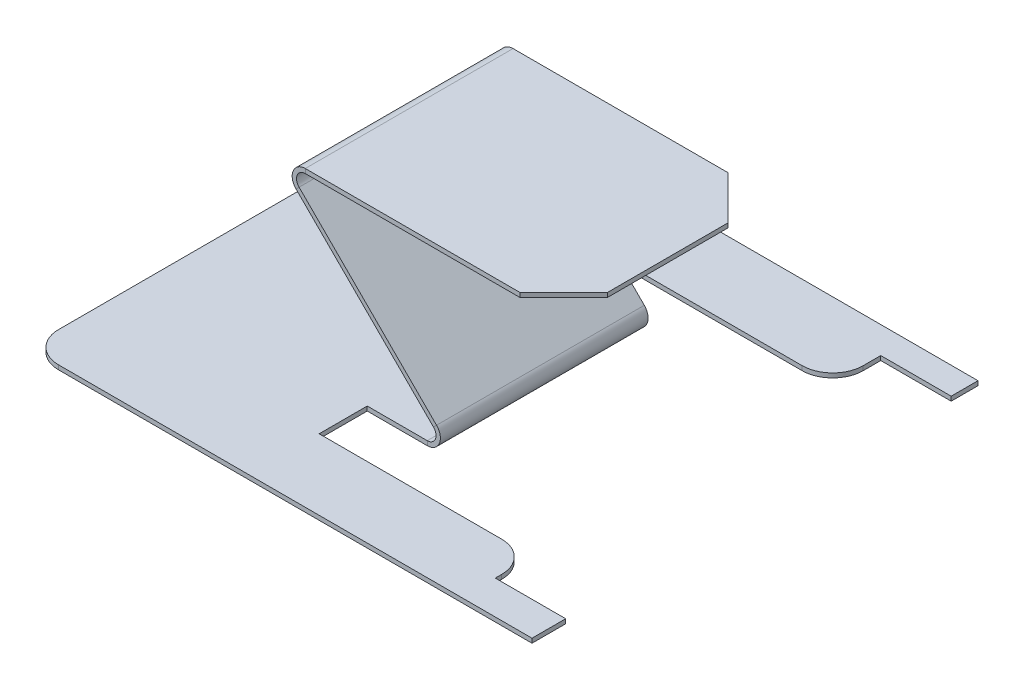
SolidWorks part; units mm, degrees
ref_plane "Front" through (0, 0, 0) normal (0, 0, 1) x (1, 0, 0)
ref_plane "Top" through (0, 0, 0) normal (0, 1, 0) x (1, 0, 0)
ref_plane "Right" through (0, 0, 0) normal (1, 0, 0) x (0, 0, -1)
sketch "Sketch1" plane through (105.9594, 0, -3.7403) normal (0, 1, 0) x (-1, 0, 0)
  line L0 (16.1231, 36.7583) -> (64.8941, 36.7583)
  line L1 (0, 52.9252) -> (115.3881, 52.9252)
  line L2 (0, 52.9252) -> (0, 45.21)
  line L3 (0, -49.1849) -> (115.3881, -49.1849)
  line L4 (115.3881, 52.9252) -> (115.3881, -49.1849)
  line L5 (64.8941, 36.7583) -> (64.8941, 25.7513)
  line L6 (64.8941, -32.0352) -> (16.1231, -32.0352)
  line L7 (16.1231, 36.7583) -> (16.1231, 45.21)
  line L8 (16.1231, 45.21) -> (0, 45.21)
  line L9 (16.1231, -32.0352) -> (16.1231, -43.0422)
  line L10 (16.1231, -43.0422) -> (0, -43.0422)
  line L11 (0, -43.0422) -> (0, -49.1849)
  line L12 (64.8941, 25.7513) -> (-9.4287, 25.7513)
  line L13 (-9.4287, 25.7513) -> (-9.4287, -21.8145)
  line L14 (-9.4287, -21.8145) -> (64.8941, -21.8145)
  line L15 (64.8941, -21.8145) -> (64.8941, -32.0352)
sheet metal parameters "Sheet-Metal2" thickness 1 parameters "D1"=2
base flange "Base-Flange2" sketch "Sketch1" thickness 1 reverse thickness direction yes parameters "D1"=2
sketch "Sketch5" plane through (0, 1, 0) normal (0, 1, 0) x (-1, 0, 0)
  line L0 (-57.7526, 22.011) -> (-57.7526, -25.5548)
  line L1 (-41.0653, 22.011) -> (-115.3881, 22.011) construction
  line L2 (-115.3881, -25.5548) -> (-41.0653, -25.5548) construction
jog "Jog5" parameters "D1"=2
bend "JogBend9" bend radius 2 bend angle 135 parameters "D5"=1
bend "JogBend10" bend radius 2 bend angle 135 parameters "D5"=2
break corner "Break-Corner1" thickness 1 parameters "D1"=2000, "D7"=5
break corner "Break-Corner3" thickness 1 parameters "D1"=2000, "D0"=7, "D7"=5
flat pattern "Flat-Pattern2"
sketch "Bend-Lines2" plane through (0, 1, 0) normal (0, 1, 0) x (-1, 0, 0)
  line L0 (-108.1406, 22.011) -> (-108.1406, -25.5548) construction
  line L1 (-57.7526, -25.5548) -> (-57.7526, 22.011) construction
bend of the flat pattern "Flatten-<JogBend9>2"
bend of the flat pattern "Flatten-<JogBend10>2"
